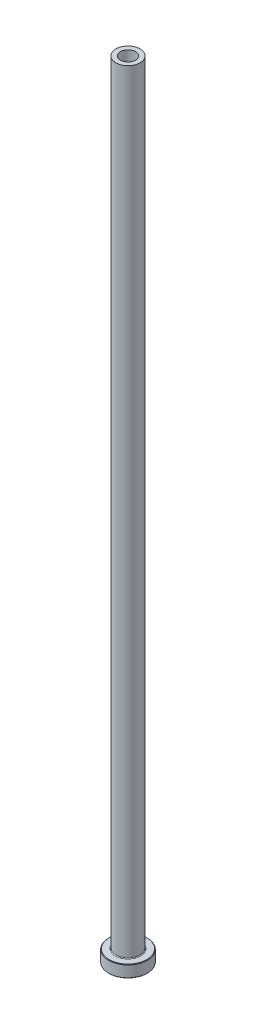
SolidWorks part; units mm, degrees
ref_plane "Front Plane" through (0, 0, 0) normal (0, 0, 1) x (1, 0, 0)
ref_plane "Top Plane" through (0, 0, 0) normal (0, 1, 0) x (1, 0, 0)
ref_plane "Right Plane" through (0, 0, 0) normal (1, 0, 0) x (0, 0, -1)
sketch "Sketch1" plane through (0, 0, 0) normal (0, 0, 1) x (1, 0, 0)
  line L0 (-3.1, 325) -> (-5, 325)
  line L1 (-5, 325) -> (-5, 5)
  line L2 (-5, 5) -> (-8, 5)
  line L3 (-8, 5) -> (-8, 0)
  line L4 (8.8, 0) -> (-8.8, 0) construction
  line L5 (-8, 0) -> (-3.35, 0)
  line L6 (-3.1, 280) -> (-3.1, 325)
  line L7 (0, 92.1877) -> (0, -15.5353) construction
  line L8 (0, -8.8) -> (0, 8.8) construction
  line L9 (-3.1, 280) -> (-3.35, 268)
  line L10 (-3.35, 268) -> (-3.35, 0)
  dimension "D1" = 0.25
  dimension "ID" = 6.2
  dimension "OD" = 10
  dimension "L" = 325
  dimension "H" = 16
  dimension "T" = 5
  dimension "N" = 45
  dimension "D2" = 12
revolve "Revolve1" add sketch "Sketch1" angle 360 about L7
fillet "Fillet1" radius 0.3 1 edges at (0, 5, 5)
chamfer "Chamfer1" distance 0.2 angle 45 2 edges at (0, 5, 8) (0, 0, 8)
chamfer "Chamfer3" distance 0.5 angle 45 1 edges at (0, 0, 3.35)
